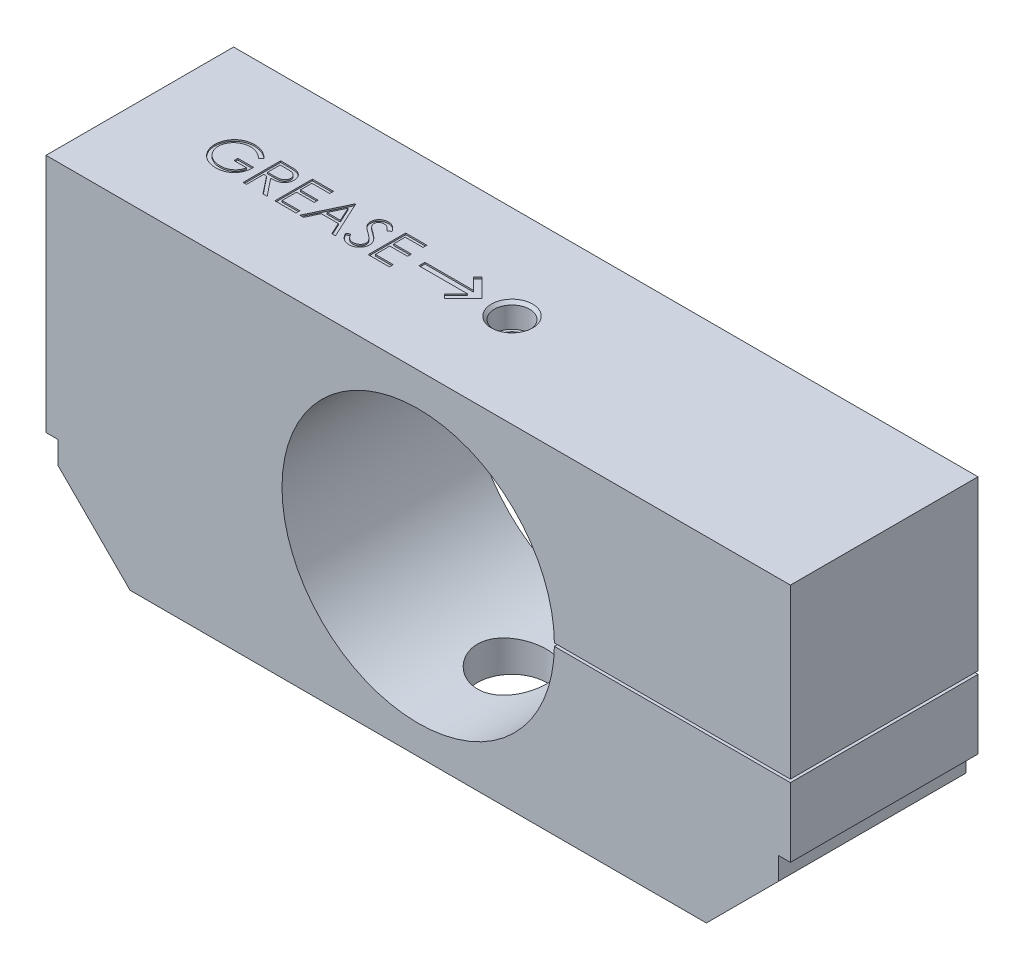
SolidWorks part; units mm, degrees
ref_plane "Front Plane" through (0, 0, 0) normal (0, 0, 1) x (1, 0, 0)
ref_plane "Top Plane" through (0, 0, 0) normal (0, 1, 0) x (1, 0, 0)
ref_plane "Right Plane" through (0, 0, 0) normal (1, 0, 0) x (0, 0, -1)
sketch "Sketch1" plane through (0, 0, 0) normal (0, 0, 1) x (1, 0, 0)
  line L0 (-31.496, 14.351) -> (31.496, 14.351)
  line L3 (31.496, 14.351) -> (31.496, -13.97)
  line L4 (31.496, -13.97) -> (-31.496, -13.97)
  line L5 (-31.496, -13.97) -> (-31.496, 14.351)
  circle A0 centre (0, 0) radius 11.5252
  point P2 (0, -13.97)
  dimension "D1" = 23.0505
  dimension "D5" = 28.321
  dimension "D2" = 62.992
  dimension "D3" = 14.351
extrude "Boss-Extrude1" add sketch "Sketch1" along normal mid plane 15.875
chamfer "Chamfer1" distance 7.112 angle 45 2 edges at (31.496, -13.97, 0) (-31.496, -13.97, 0)
sketch "Sketch8" plane through (0, 0, 7.9375) normal (0, 0, 1) x (1, 0, 0)
  line L0 (-30.48, -7.874) -> (-30.48, -5.969)
  line L1 (-31.496, -6.858) -> (-24.384, -13.97) construction
  line L2 (-30.48, -5.969) -> (-31.496, -5.969)
  line L3 (-31.496, 14.351) -> (-31.496, -6.858) construction
  line L4 (-31.496, -5.969) -> (-31.496, -6.858)
  line L5 (-31.496, -6.858) -> (-30.48, -7.874)
  line L8 (0, 18.915) -> (0, -18.8872) construction
  line L9 (31.496, -6.858) -> (30.48, -7.874)
  line L10 (31.496, -5.969) -> (31.496, -6.858)
  line L11 (30.48, -5.969) -> (31.496, -5.969)
  line L12 (30.48, -7.874) -> (30.48, -5.969)
  dimension "D1" = 1.016
  dimension "D2" = 1.905
extrude "Cut-Extrude2" cut sketch "Sketch8" against normal through all
hole_wizard "5/16 (0.3125) Diameter Hole1" positions "Sketch4" profile "Sketch5" hole size "5/16" standard "ANSI Inch"
sketch "Sketch4" plane through (-26.5135, -13.97, 6.4492) normal (0, -1, 0) x (1, 0, 0)
  line L0 (6.1935, -6.4492) -> (46.8335, -6.4492) construction
  point P0 (6.1935, -6.4492)
  point P11 (46.8335, -6.4492)
  dimension "D1" = 40.64
sketch "Sketch5" plane through (-20.32, -13.97, 0) normal (1, 0, 0) x (0, 0, -1)
  line L0 (0, 0) -> (0, 13.716)
  line L1 (0, 13.716) -> (3.9687, 13.716)
  line L2 (3.9687, 13.716) -> (3.9687, 0)
  line L5 (3.9687, 0) -> (0, 0)
  line L10 (0, 13.716) -> (-3.9688, 13.716) construction
  line L11 (0, -6.35) -> (0, 107.95) construction
  dimension "Hole Dia." = 7.9375
  dimension "Hole Depth" = 13.716
  dimension "Drill Angle" = 180
hole_wizard "1/4-20 Tapped Hole1" positions "Sketch11" profile "Sketch10" tap size "1/4-20" standard "Ansi Inch"
sketch "Sketch11" plane through (-21.5106, -0.254, 1.1697) normal (0, -1, 0) x (1, 0, 0)
  point P0 (1.1906, -1.1697)
  point P1 (41.8306, -1.1697)
sketch "Sketch10" plane through (-20.32, -0.254, 0) normal (1, 0, 0) x (0, 0, -1)
  line L0 (0, 0) -> (0, 13.2178)
  line L1 (0, 13.2178) -> (2.5527, 11.684)
  line L2 (2.5527, 11.684) -> (2.5527, 10.414)
  line L3 (2.5527, 10.414) -> (3.175, 10.414)
  line L4 (3.175, 10.414) -> (3.175, 0)
  line L5 (3.175, 0) -> (0, 0)
  line L10 (0, 13.2178) -> (-2.5527, 11.684) construction
  line L11 (0, -6.35) -> (0, 107.95) construction
  dimension "Tap Drill Dia." = 5.1054
  dimension "Tap Drill Depth" = 11.684
  dimension "Thread Major Dia." = 6.35
  dimension "Thread Depth" = 10.414
  dimension "Drill Angle" = 118
sketch "Sketch9" plane through (0, 0, 7.9375) normal (0, 0, 1) x (1, 0, 0)
  line L0 (31.496, -5.969) -> (31.496, 14.351) construction
  line L1 (31.496, 0.127) -> (0, 0.127)
  line L2 (31.496, 0.127) -> (31.496, -0.127)
  line L3 (31.496, -0.127) -> (0, -0.127)
  line L4 (0, 0.127) -> (0, -0.127)
  point P6 (31.496, 0)
  dimension "D1" = 0.254
extrude "Cut-Extrude3 SPLIT" cut sketch "Sketch9" against normal through all
sketch "Sketch7" plane through (0, -13.97, 0) normal (0, -1, 0) x (1, 0, 0)
  circle A0 centre (0, 0) radius 2.921
  dimension "D1" = 5.842
extrude "Cut-Extrude1 LOCATING PIN CLEARANCE" cut sketch "Sketch7" against normal up to next
hole_wizard "M3x0.5 Tapped Hole1" positions "Sketch13" profile "Sketch14" tap size "M3x0.5" standard "ANSI Metric"
sketch "Sketch13" plane through (0, 14.351, 0) normal (0, 1, 0) x (1, 0, 0)
  point P0 (0, 0)
sketch "Sketch14" plane through (0, 14.351, 0) normal (1, 0, 0) x (0, 0, 1)
  line L0 (0, 0) -> (0, 2.8257)
  line L1 (0, 2.8257) -> (1.25, 2.8257)
  line L3 (1.25, 2.8257) -> (1.25, 2.032)
  line L4 (1.5, 2.032) -> (1.25, 2.032)
  line L5 (1.5, 2.032) -> (1.5, 0.25)
  line L6 (1.5, 0.25) -> (1.75, 0)
  line L7 (1.75, 0) -> (0, 0)
  line L8 (-1.5, 0.25) -> (-1.75, 0) construction
  line L11 (0, -6.35) -> (0, 107.95) construction
  dimension "Thru Tap Drill Dia." = 2.5
  dimension "Thru Tap Drill Depth" = 2.8257
  dimension "Thread Major Dia." = 3
  dimension "Thread Depth" = 2.032
  dimension "Near C'Sink Dia." = 3.5
  dimension "Near C'Sink Angle" = 90
sketch "Sketch15" plane through (0, 14.351, 0) normal (0, 1, 0) x (1, 0, 0)
  line L0 (-25.4, -1.5875) -> (0, -1.5875) construction
  line L1 (0, -1.5875) -> (0, 0) construction
  line L2 (-7.62, 0.254) -> (-7.62, -0.254)
  line L3 (-7.62, -0.254) -> (-3.5124, -0.254)
  line L4 (-3.5124, -0.254) -> (-4.4867, -1.2283)
  line L5 (-4.4867, -1.2283) -> (-4.1275, -1.5875)
  line L6 (-4.1275, -1.5875) -> (-2.54, 0)
  line L7 (-7.62, 0) -> (-2.54, 0) construction
  line L8 (-4.1275, 1.5875) -> (-2.54, 0)
  line L9 (-4.4867, 1.2283) -> (-4.1275, 1.5875)
  line L10 (-3.5124, 0.254) -> (-4.4867, 1.2283)
  line L11 (-7.62, 0.254) -> (-3.5124, 0.254)
  text T0 "GREASE" font "Century Gothic" height 3.175
  dimension "D1" = 1.5875
  dimension "D2" = 25.4
  dimension "D3" = 45
  dimension "D4" = 0.508
  dimension "D5" = 0.508
  dimension "D6" = 5.08
  dimension "D7" = 2.54
extrude "Cut-Extrude3" cut sketch "Sketch15" against normal blind 0.127
